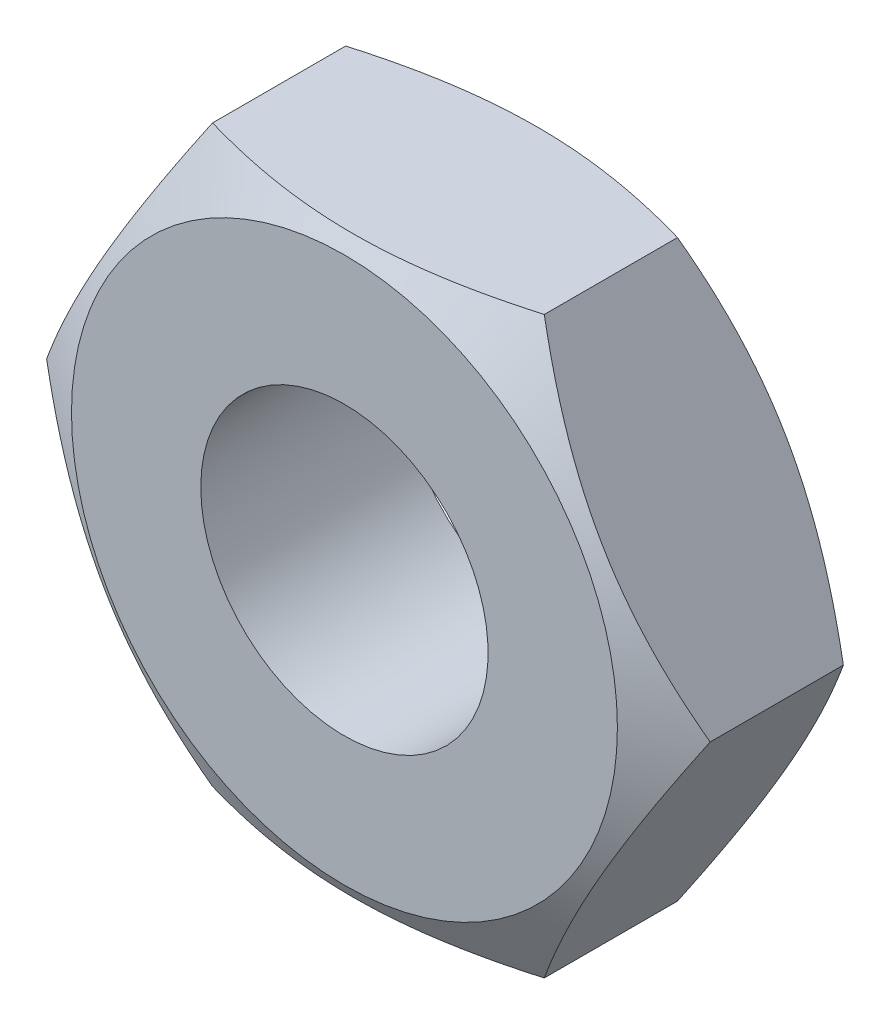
SolidWorks part; units mm, degrees
extrude "Base-Extrusion" add sketch "Esquisse1" along normal blind 3.5
sketch "Esquisse1" plane through (0, 0, 0) normal (0, 0, 1) x (1, 0, 0)
  line L0 (0, 0) -> (0, 60.5083) construction
  line L1 (0, 0) -> (52.6683, 0) construction
  line L2 (-5.7735, 0) -> (-2.8868, 5)
  line L3 (-2.8868, 5) -> (2.8868, 5)
  line L4 (2.8868, 5) -> (5.7735, 0)
  line L5 (5.7735, 0) -> (2.8868, -5)
  line L6 (2.8868, -5) -> (-2.8868, -5)
  line L7 (-2.8868, -5) -> (-5.7735, 0)
  dimension "D1" = 120
  dimension "D2" = 10
ref_plane "Plane1" through (0, 0, 0) normal (0, 0, 1) x (1, 0, 0)
ref_plane "Plane2" through (0, 0, 0) normal (0, 1, 0) x (1, 0, 0)
ref_plane "Plane3" through (0, 0, 0) normal (1, 0, 0) x (0, 0, -1)
sketch "Esquisse3" plane through (0, 0, 0) normal (0, 1, 0) x (1, 0, 0)
  line L2 (-2.8868, 0) -> (2.8868, 0) construction
  line L3 (-5.7735, -3.5) -> (-5.7735, 0) construction
  line L4 (-5.7735, 0) -> (-2.8868, 0) construction
  line L5 (-4.75, 0) -> (-5.7735, 0)
  line L6 (-4.75, 0) -> (-5.7735, -0.5909)
  line L7 (0, 2.8527) -> (0, -4.5118) construction
  line L8 (-5.7735, 0) -> (-5.7735, -0.5909)
revolve "Enlever de la matière-Révolution1" cut sketch "Esquisse3" angle 360 about L7
ref_plane "Plan4" through (0, 0, 1.75) normal (0, 0, -1) x (-1, 0, 0)
mirror "Symétrie1" about plane through (0, 0, 1.75) normal (0, 0, -1)
hole_wizard "Perçage1" positions "Esquisse5" profile "Esquisse4" tap size "M6x1.0" standard "ISO"
sketch "Esquisse5" plane through (0, 0, 0) normal (0, 0, -1) x (-1, 0, 0)
  circle A1 centre (0, 0) radius 4.75 construction
  point P0 (0, 0)
sketch "Esquisse4" plane through (0, 0, 0) normal (1, 0, 0) x (0, 1, 0)
  line L0 (0, 0) -> (0, 3.5)
  line L1 (0, 3.5) -> (2.5, 3.5)
  line L2 (2.5, 3.5) -> (2.5, 0)
  line L5 (2.5, 0) -> (0, 0)
  line L11 (0, -6.35) -> (0, 107.95) construction
  dimension "Diamètre du perçage jusqu'au prochain" = 5
  dimension "Profondeur du perçage jusqu'au prochain" = 3.5
equation "\"D2@Esquisse3\" =( \"D2@Esquisse1\"-0.5)/2"
equation "\"D1@Plan4\" = \"D1@Base-Extrusion\"/2"
